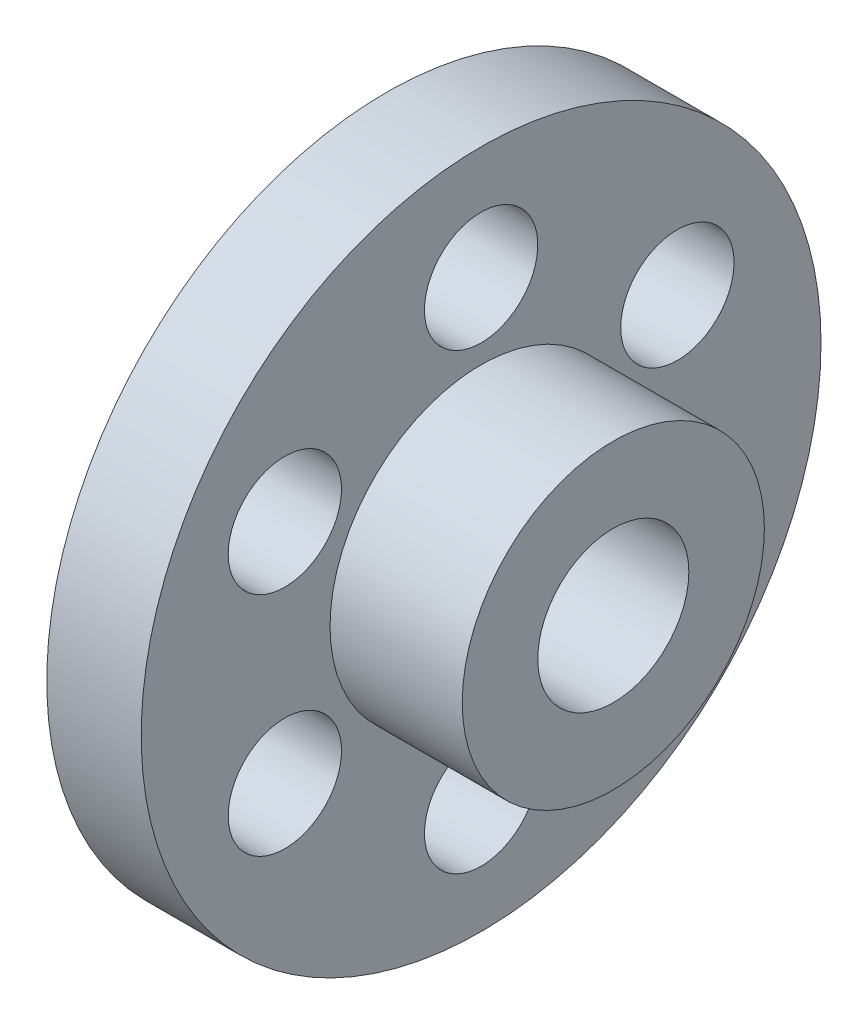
SolidWorks part; units mm, degrees
ref_plane "Płaszczyzna przednia" through (0, 0, 0) normal (0, 0, 1) x (1, 0, 0)
ref_plane "Płaszczyzna górna" through (0, 0, 0) normal (0, 1, 0) x (1, 0, 0)
ref_plane "Płaszczyzna prawa" through (0, 0, 0) normal (1, 0, 0) x (0, 0, -1)
sketch "Szkic1" plane through (0, 0, 0) normal (0, 0, 1) x (1, 0, 0)
  line L0 (0, 0) -> (0, 90)
  line L1 (0, 90) -> (25, 90)
  line L2 (25, 90) -> (25, 40)
  line L3 (25, 40) -> (60, 40)
  line L4 (60, 40) -> (60, 0)
  line L5 (60, 0) -> (0, 0)
  line L6 (0, 0) -> (-33.1757, 0) construction
  dimension "D1" = 180
  dimension "D2" = 80
  dimension "D3" = 25
  dimension "D4" = 60
revolve "Obrót1" add sketch "Szkic1" angle 360 about L6
sketch "Szkic2" plane through (60, 0, 0) normal (1, 0, 0) x (0, 0, -1)
  circle A0 centre (0, 0) radius 20
  dimension "D1" = 40
extrude "Wytnij-wyciągnięcie1" cut sketch "Szkic2" against normal through all
sketch "Szkic3" plane through (0, 0, 0) normal (-1, 0, 0) x (0, 0, 1)
  circle A0 centre (0, 0) radius 60 construction
  circle A1 centre (0, 60) radius 15
  dimension "D1" = 120
  dimension "D2" = 30
extrude "Wytnij-wyciągnięcie2" cut sketch "Szkic3" against normal through all
pattern_circular "Szyk kołowy1" count 6 over 360 about axis through (0, 0, 0) along (1, 0, 0) of "Wytnij-wyciągnięcie2"
